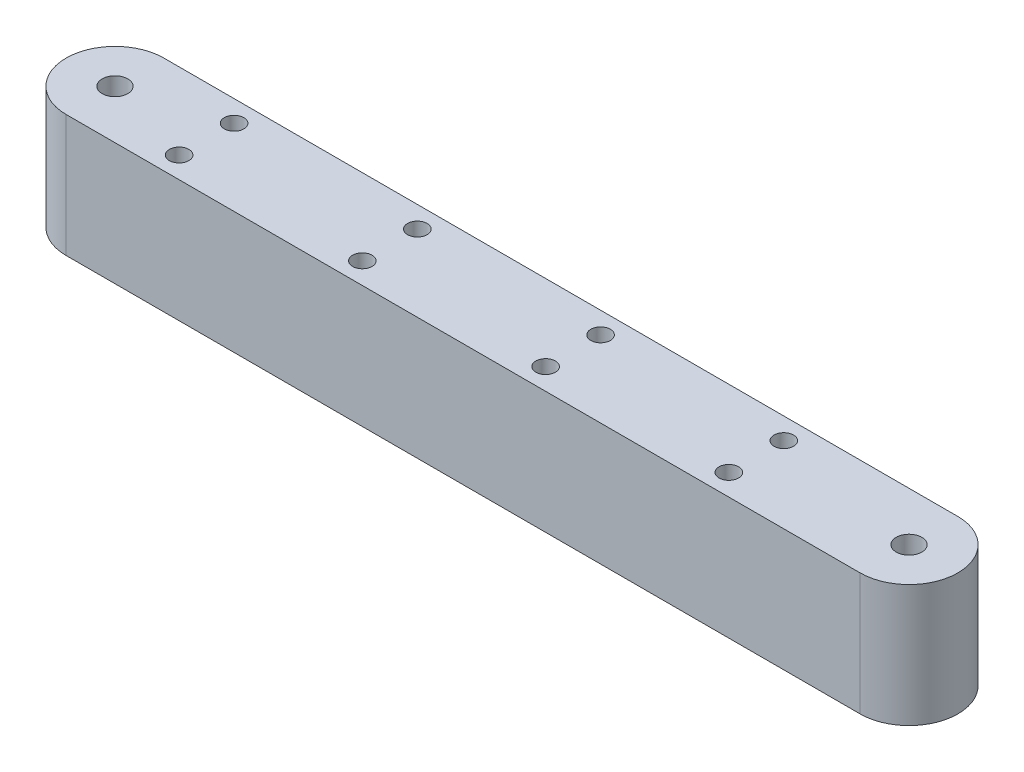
SolidWorks part; units mm, degrees
ref_plane "前视基准面" through (0, 0, 0) normal (0, 0, 1) x (1, 0, 0)
ref_plane "上视基准面" through (0, 0, 0) normal (0, 1, 0) x (1, 0, 0)
ref_plane "右视基准面" through (0, 0, 0) normal (1, 0, 0) x (0, 0, -1)
other "Configuration Table"
sketch "草图1" plane through (0, 0, 0) normal (0, 1, 0) x (1, 0, 0)
  line L0 (-65, 0) -> (65, 0) construction
  line L1 (-65, 8) -> (65, 8)
  line L2 (-65, -8) -> (65, -8)
  arc A0 (-65, 8) -> (-65, -8) centre (-65, 0) ccw
  arc A1 (65, -8) -> (65, 8) centre (65, 0) ccw
  circle A2 centre (-65, 0) radius 2.1
  circle A3 centre (65, 0) radius 2.1
  point P3 (0, 0)
  dimension "D2" = 4.2
  dimension "D3" = 4.2
  dimension "D1" = 130
  dimension "D4" = 16
extrude "凸台-拉伸1" add sketch "草图1" along normal blind 20
sketch "草图2" plane through (0, 20, 0) normal (0, 1, 0) x (1, 0, 0)
  line L0 (65, 8) -> (-65, 8) construction
  line L1 (-50, 4.5) -> (-20, 4.5) construction
  line L2 (-50, 4.5) -> (-50, -4.5) construction
  circle A0 centre (-50, 4.5) radius 1.6
  circle A1 centre (-20, 4.5) radius 1.6
  circle A2 centre (10, 4.5) radius 1.6
  circle A3 centre (40, 4.5) radius 1.6
  circle A4 centre (-20, -4.5) radius 1.6
  circle A5 centre (10, -4.5) radius 1.6
  circle A6 centre (40, -4.5) radius 1.6
  circle A7 centre (-50, -4.5) radius 1.6
  dimension "D1" = 3.2
  dimension "D8" = 4
  dimension "D2" = 3.5
  dimension "D4" = 90
  dimension "D5" = 20
  dimension "D6" = 9
  dimension "D7" = 30
  dimension "D3" = 2
extrude "切除-拉伸1" cut sketch "草图2" against normal through all
